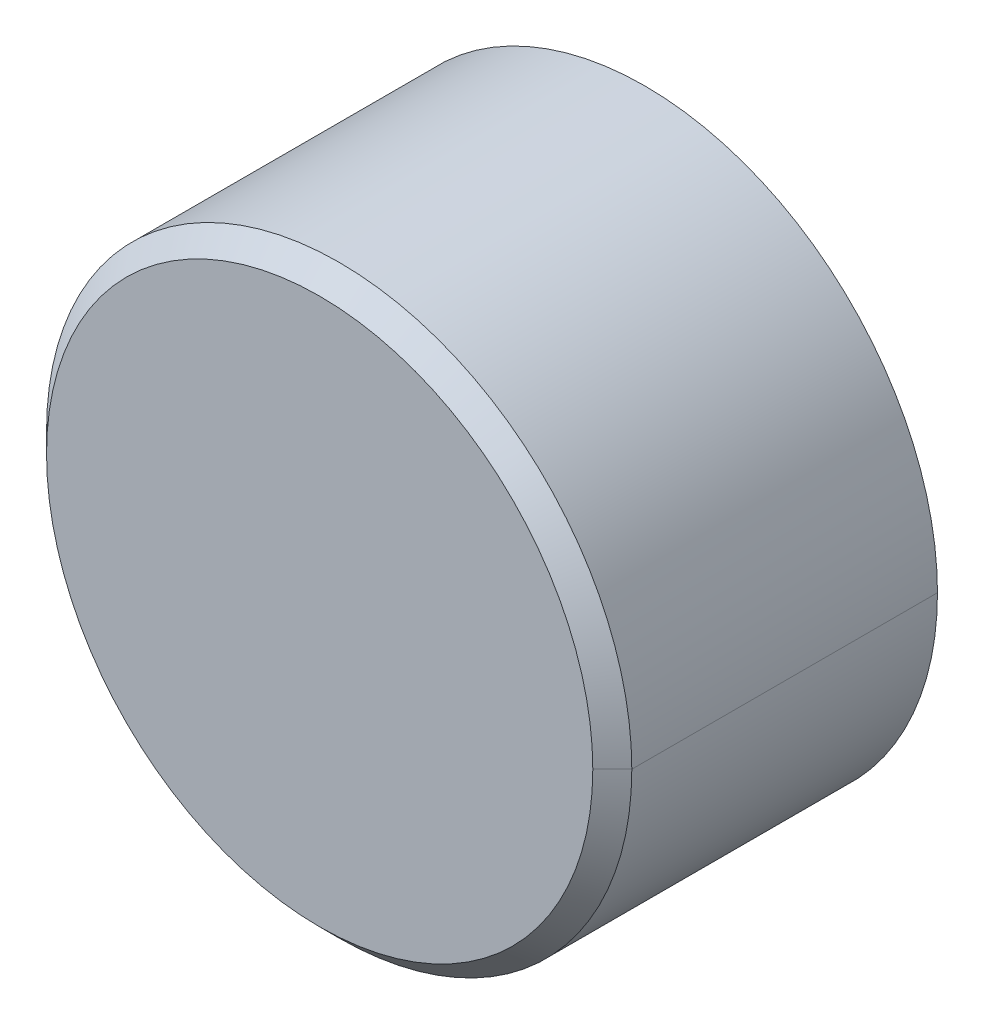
SolidWorks part; units mm, degrees
ref_plane "Front Plane" through (0, 0, 0) normal (0, 0, 1) x (1, 0, 0)
ref_plane "Top Plane" through (0, 0, 0) normal (0, 1, 0) x (1, 0, 0)
ref_plane "Right Plane" through (0, 0, 0) normal (1, 0, 0) x (0, 0, -1)
body saved out of another part "Stock-XM,H-430_idler.stp-1"
split "Split1" bodies to split 101 resulting bodies 102
